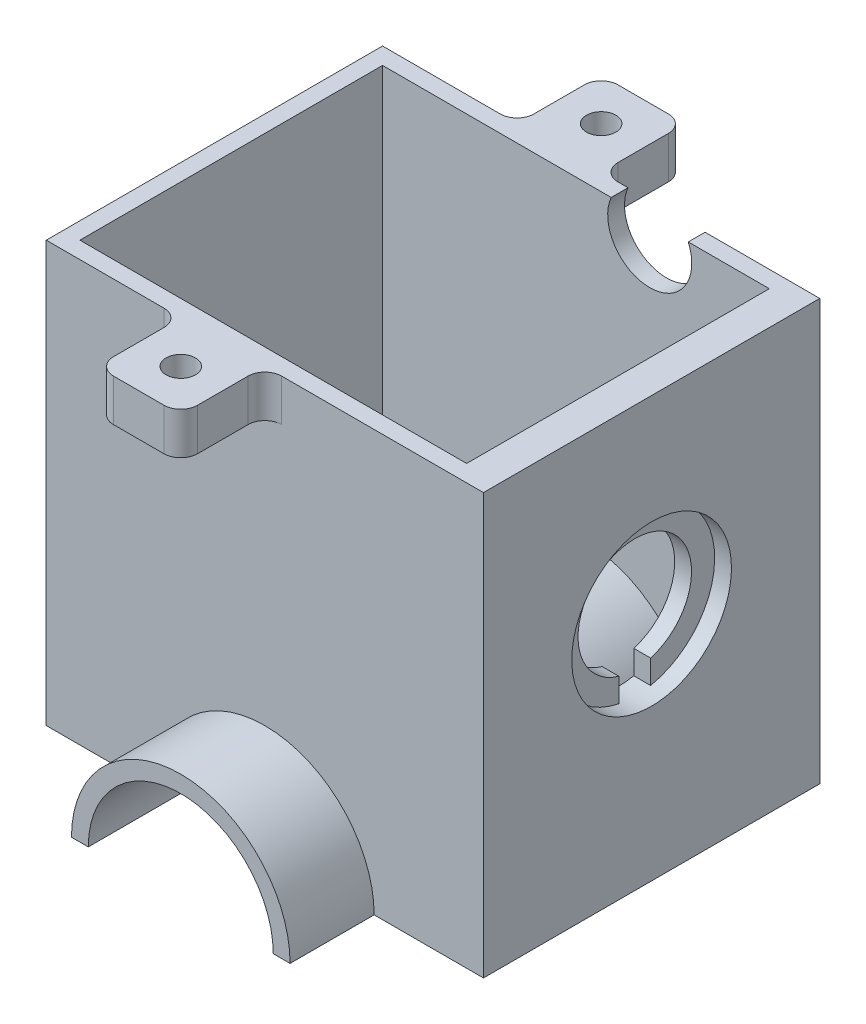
SolidWorks part; units mm, degrees
ref_plane "Front Plane" through (0, 0, 0) normal (0, 0, 1) x (1, 0, 0)
ref_plane "Top Plane" through (0, 0, 0) normal (0, 1, 0) x (1, 0, 0)
ref_plane "Right Plane" through (0, 0, 0) normal (1, 0, 0) x (0, 0, -1)
sketch "Sketch1" plane through (0, 0, 0) normal (0, 0, 1) x (1, 0, 0)
  line L0 (16, 0) -> (26, 0)
  line L1 (-26, 0) -> (-26, 50)
  line L2 (-26, 50) -> (26, 50)
  line L3 (-16, 0) -> (-26, 0)
  line L4 (26, 50) -> (26, 0)
  line L6 (-16, 0) -> (16, 0)
  circle A1 centre (0, 0) radius 11
  point P13 (-20.5, 4)
  dimension "D1" = 50
  dimension "D6" = 22
  dimension "D2" = 10
  dimension "D3" = 10
extrude "Boss-Extrude1" add sketch "Sketch1" along normal blind 40
shell "Shell1" thickness 2
sketch "Sketch2" plane through (0, 0, 38) normal (0, 0, -1) x (-1, 0, 0)
  line L0 (0, 13) -> (24, 13)
  line L1 (24, 2) -> (24, 50) construction
  line L2 (24, 13) -> (24, 2)
  line L3 (24, 2) -> (12.8452, 2)
  line L5 (0, 13) -> (0, 0)
  line L6 (-24, 2) -> (-24, 5)
  line L7 (-24, 50) -> (-24, 2) construction
  line L8 (-24, 5) -> (-12, 5)
  line L9 (-12.8452, 2) -> (-24, 2)
  arc A0 (12.8452, 2) -> (-12.8452, 2) centre (0, 0) ccw construction
  circle A1 centre (0, 0) radius 13
  dimension "D1" = 3
extrude "Boss-Extrude2" add sketch "Sketch2" along normal blind 36 contours L0 M1 M2 M3
sketch "Sketch4" plane through (0, 0, 38) normal (0, 0, -1) x (-1, 0, 0)
  line L0 (-24, 2) -> (-12.8452, 2)
  line L1 (-24, 2) -> (-24, 5)
  line L2 (-24, 50) -> (-24, 2) construction
  line L3 (-24, 5) -> (-12, 5)
  circle A0 centre (0, 0) radius 13
  dimension "D1" = 3
extrude "Boss-Extrude3" add sketch "Sketch4" along normal blind 36 contours L3 M6 M7 M2
sketch "Sketch3" plane through (0, 0, 0) normal (0, -1, 0) x (1, 0, 0)
  line L0 (-26, 40) -> (-11, 0)
  line L1 (11, 40) -> (26, 0)
  circle A0 centre (-18.5, 20) radius 2
  circle A1 centre (18.5, 20) radius 2
  dimension "D1" = 4
  dimension "D2" = 4
extrude "Cut-Extrude1" cut sketch "Sketch3" against normal blind 36 contours L1 A1 | L1 A1 | L0 A0 | L0 A0
sketch "Sketch5" plane through (0, 5, 0) normal (0, 1, 0) x (1, 0, 0)
  line L1 (18.5, -23.4641) -> (21.5, -21.7321)
  line L2 (21.5, -21.7321) -> (21.5, -18.2679)
  line L3 (21.5, -18.2679) -> (18.5, -16.5359)
  line L4 (18.5, -16.5359) -> (15.5, -18.2679)
  line L5 (15.5, -18.2679) -> (15.5, -21.7321)
  line L6 (15.5, -21.7321) -> (18.5, -23.4641)
  circle A0 centre (18.5, -20) radius 3 construction
  point P0 (18.5, -20)
  dimension "D1" = 6
extrude "Cut-Extrude2" cut sketch "Sketch5" against normal blind 3
sketch "Sketch7" plane through (0, 13, 0) normal (0, 1, 0) x (1, 0, 0)
  line L1 (-18.0909, -23.4399) -> (-15.3164, -21.3656)
  line L2 (-15.3164, -21.3656) -> (-15.7256, -17.9258)
  line L3 (-15.7256, -17.9258) -> (-18.9091, -16.5601)
  line L4 (-18.9091, -16.5601) -> (-21.6836, -18.6344)
  line L5 (-21.6836, -18.6344) -> (-21.2744, -22.0742)
  line L6 (-21.2744, -22.0742) -> (-18.0909, -23.4399)
  circle A0 centre (-18.5, -20) radius 3 construction
  point P0 (-18.5, -20)
  dimension "D1" = 6
extrude "Cut-Extrude3" cut sketch "Sketch7" against normal blind 11
sketch "Sketch9" plane through (0, 13, 0) normal (0, 1, 0) x (1, 0, 0)
  line L0 (-17.082, -2) -> (-17.082, -38)
  line L1 (0, -2) -> (-24, -2) construction
  line L2 (-24, -38) -> (24, -38) construction
  circle A0 centre (-17.082, -12.38) radius 1.27
  circle A1 centre (-17.082, -27.62) radius 1.27
  point P10 (-17.082, -20)
  dimension "D1" = 2.54
  dimension "D2" = 2.54
  dimension "D3" = 15.24
  dimension "D4" = 7.62
extrude "Cut-Extrude4" cut sketch "Sketch9" against normal through all contours A0 | A1
sketch "Sketch10" plane through (0, 0, 0) normal (0, -1, 0) x (1, 0, 0)
  circle A0 centre (-17.082, 27.62) radius 2.5
  circle A1 centre (-17.082, 12.38) radius 2.5
  dimension "D1" = 5
  dimension "D2" = 5
extrude "Cut-Extrude5" cut sketch "Sketch10" against normal blind 11
sketch "Sketch12" plane through (0, 5, 0) normal (0, 1, 0) x (1, 0, 0)
  line L0 (24, -38) -> (12, -38) construction
  line L1 (24, -2) -> (22, -2)
  line L2 (24, -2) -> (24, -38)
  line L3 (24, -38) -> (22, -38)
  line L4 (22, -2) -> (22, -38)
  dimension "D1" = 2
extrude "Boss-Extrude4" add sketch "Sketch12" along normal blind 45
sketch "Sketch14" plane through (22, 0, 0) normal (-1, 0, 0) x (0, 0, 1)
  line L0 (38, 50) -> (2, 5)
  circle A0 centre (20, 27.5) radius 6.75
  dimension "D1" = 13.5
extrude "Cut-Extrude6" cut sketch "Sketch14" against normal through all contours A0
sketch "Sketch15" plane through (26, 0, 0) normal (1, 0, 0) x (0, 0, -1)
  circle A0 centre (-20, 27.5) radius 9.5
  point P0 (-20, 27.5)
  dimension "D1" = 19
extrude "Cut-Extrude7" cut sketch "Sketch15" against normal blind 2
sketch "Sketch16" plane through (0, 0, 0) normal (0, 0, -1) x (-1, 0, 0)
  line L0 (26, 50) -> (-26, 50) construction
  line L2 (0, 50) -> (10, 50)
  line L3 (0, 50) -> (0, 45)
  line L4 (0, 45) -> (10, 45)
  line L5 (10, 50) -> (10, 45)
  point P0 (0, 50)
  dimension "D1" = 5
  dimension "D2" = 10
extrude "Boss-Extrude5" add sketch "Sketch16" along normal blind 10
sketch "Sketch17" plane through (0, 0, 40) normal (0, 0, 1) x (1, 0, 0)
  line L0 (-26, 50) -> (26, 50) construction
  line L2 (0, 50) -> (-10, 50)
  line L3 (0, 50) -> (0, 45)
  line L4 (0, 45) -> (-10, 45)
  line L5 (-10, 50) -> (-10, 45)
  point P0 (0, 50)
  dimension "D1" = 5
  dimension "D2" = 10
extrude "Boss-Extrude6" add sketch "Sketch17" along normal blind 10
sketch "Sketch18" plane through (0, 45, 0) normal (0, -1, 0) x (1, 0, 0)
  line L0 (-10, 50) -> (0, 40)
  line L1 (11, 40) -> (-11, 40) construction
  line L2 (-10, 0) -> (0, -10)
  line L4 (-3.9474, 48.3003) -> (-7.3318, 47.5617)
  line L5 (-7.3318, 47.5617) -> (-8.3845, 44.2614)
  line L6 (-8.3845, 44.2614) -> (-6.0526, 41.6997)
  line L7 (-6.0526, 41.6997) -> (-2.6682, 42.4383)
  line L8 (-2.6682, 42.4383) -> (-1.6155, 45.7386)
  line L9 (-1.6155, 45.7386) -> (-3.9474, 48.3003)
  line L10 (-4.167, -1.6376) -> (-7.4955, -2.5973)
  line L11 (-7.4955, -2.5973) -> (-8.3285, -5.9598)
  line L12 (-8.3285, -5.9598) -> (-5.833, -8.3624)
  line L13 (-5.833, -8.3624) -> (-2.5045, -7.4027)
  line L14 (-2.5045, -7.4027) -> (-1.6715, -4.0402)
  line L15 (-1.6715, -4.0402) -> (-4.167, -1.6376)
  circle A0 centre (-5, 45) radius 3 construction
  circle A1 centre (-5, -5) radius 3 construction
  dimension "D1" = 6
  dimension "D2" = 6
extrude "Cut-Extrude8" cut sketch "Sketch18" against normal blind 2 contours L4 L5 L6 L7 L8 L9 | L10 L11 L12 L13 L14 L15
sketch "Sketch20" plane through (0, 47, 0) normal (0, -1, 0) x (1, 0, 0)
  line L0 (-10, 50) -> (0, 40)
  line L1 (11, 40) -> (-11, 40) construction
  line L2 (0, -10) -> (-10, 0)
  circle A0 centre (-5, 45) radius 1.75
  circle A1 centre (-5, -5) radius 1.75
  dimension "D1" = 3.5
  dimension "D2" = 3.5
extrude "Cut-Extrude9" cut sketch "Sketch20" against normal through all contours A0 | A1
fillet "Fillet1" radius 2 8 edges at (0, 47.5, 40) (0, 47.5, 50) (-10, 47.5, 50) (-10, 47.5, 40) (-10, 47.5, 0) (-10, 47.5, -10) (0, 47.5, -10) (0, 47.5, 0)
sketch "Sketch21" plane through (0, 0, 38) normal (0, 0, -1) x (-1, 0, 0)
  line L0 (24, 13) -> (-22, 50)
  circle A0 centre (3.5693, 29.4334) radius 7.5
  dimension "D1" = 15
sketch "Sketch22" plane through (24, 0, 0) normal (1, 0, 0) x (0, 0, -1)
  line L0 (-21.8815, 21.0175) -> (-21.8815, 18.1882)
  line L5 (-18.1185, 21.0175) -> (-18.1185, 18.1882)
  circle A3 centre (-20, 27.5) radius 6.75
  circle A4 centre (-20, 27.5) radius 9.5
extrude "Cut-Extrude12" cut sketch "Sketch22" against normal blind 10 contours L5 L0 M3 M2
sketch "Sketch24" plane through (0, 0, 0) normal (0, 0, -1) x (-1, 0, 0)
  line L0 (-2, 50) -> (-26, 50) construction
  line L1 (-12.7774, 50) -> (-2.7774, 50)
  line L2 (-12.7774, 50) -> (-12.7774, 48)
  line L3 (-12.7774, 48) -> (-2.7774, 48)
  line L4 (-2.7774, 50) -> (-2.7774, 48)
  circle A0 centre (-7.7774, 48) radius 5
  dimension "D1" = 2
  dimension "D2" = 10
extrude "Cut-Extrude13" cut sketch "Sketch24" against normal blind 10 contours L3 A0 L1 | L3 A0
sketch "Sketch25" plane through (0, 0, 0) normal (0, 0, -1) x (-1, 0, 0)
  line L0 (-13, 0) -> (13, 0)
  circle A0 centre (0, 0) radius 11
  circle A1 centre (0, 0) radius 13
  dimension "D1" = 26
extrude "Boss-Extrude8" add sketch "Sketch25" along normal blind 10 contours A1 M8 M6 M7
sketch "Sketch26" plane through (0, 0, 40) normal (0, 0, 1) x (1, 0, 0)
  line L0 (-13, 0) -> (13, 0)
  circle A0 centre (0, 0) radius 11
  circle A1 centre (0, 0) radius 13
  dimension "D1" = 22
  dimension "D2" = 26
extrude "Boss-Extrude9" add sketch "Sketch26" along normal blind 10 contours A1 M9 M7 M8
